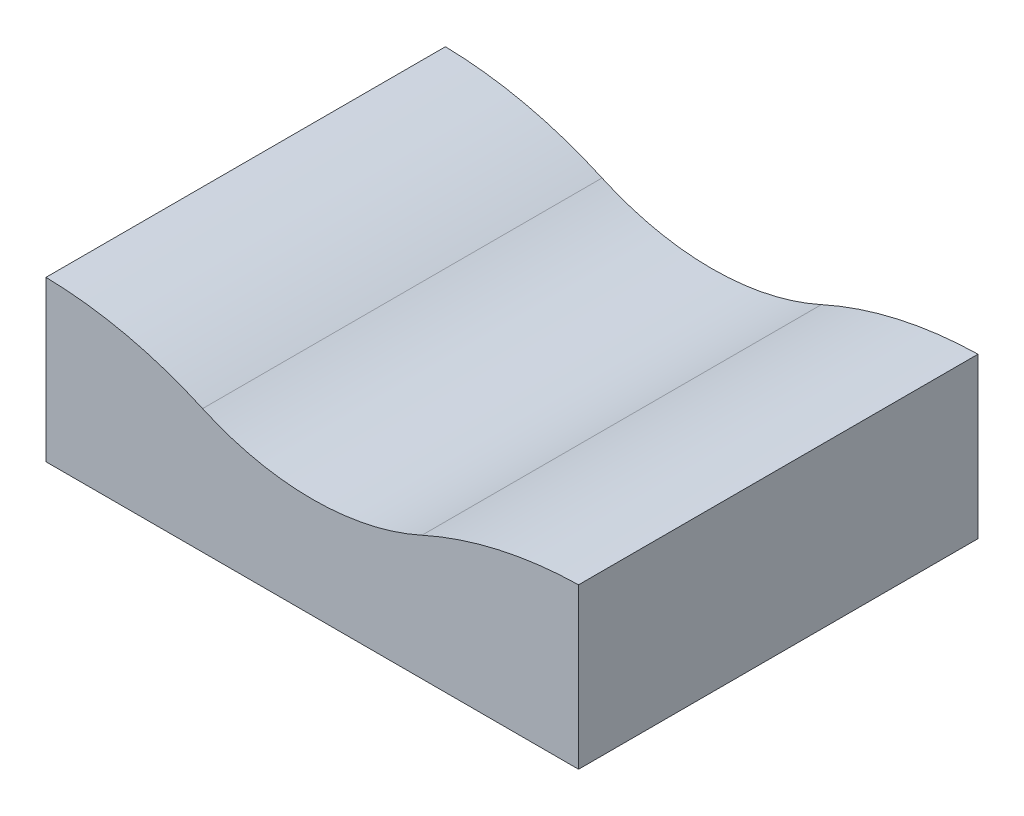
SolidWorks part; units mm, degrees
ref_plane "Front Plane" through (0, 0, 0) normal (0, 0, 1) x (1, 0, 0)
ref_plane "Top Plane" through (0, 0, 0) normal (0, 1, 0) x (1, 0, 0)
ref_plane "Right Plane" through (0, 0, 0) normal (1, 0, 0) x (0, 0, -1)
sketch "Sketch1" plane through (0, 0, 0) normal (0, 0, 1) x (1, 0, 0)
  line L0 (100, 0) -> (-100, 0)
  line L1 (-100, 0) -> (-100, 60)
  line L2 (20, 35) -> (20, 20)
  line L3 (20, 20) -> (-20, 20)
  line L4 (0, 0) -> (0, 70.0676) construction
  line L5 (-20, 35) -> (-20, 20)
  line L8 (100, 0) -> (100, 60)
  arc A0 (100, 60) -> (20, 35) centre (102.9596, -89.9708) ccw
  arc A1 (-100, 60) -> (-20, 35) centre (-102.9596, -89.9708) cw
  point P13 (0, 20)
  dimension "D3" = 150
  dimension "D1" = 100
  dimension "D2" = 60
  dimension "D4" = 20
  dimension "D5" = 15
  dimension "D6" = 20
extrude "Extrude1" add sketch "Sketch1" along normal mid plane 150
fillet "Fillet1" radius 100 10 edges at (-20, 35, 0) (-20, 20, 0) (20, 20, 0) (20, 35, 0) (20, 27.5, 75) (0, 20, 75) (-20, 27.5, 75) (-20, 27.5, -75) (0, 20, -75) (20, 27.5, -75)
